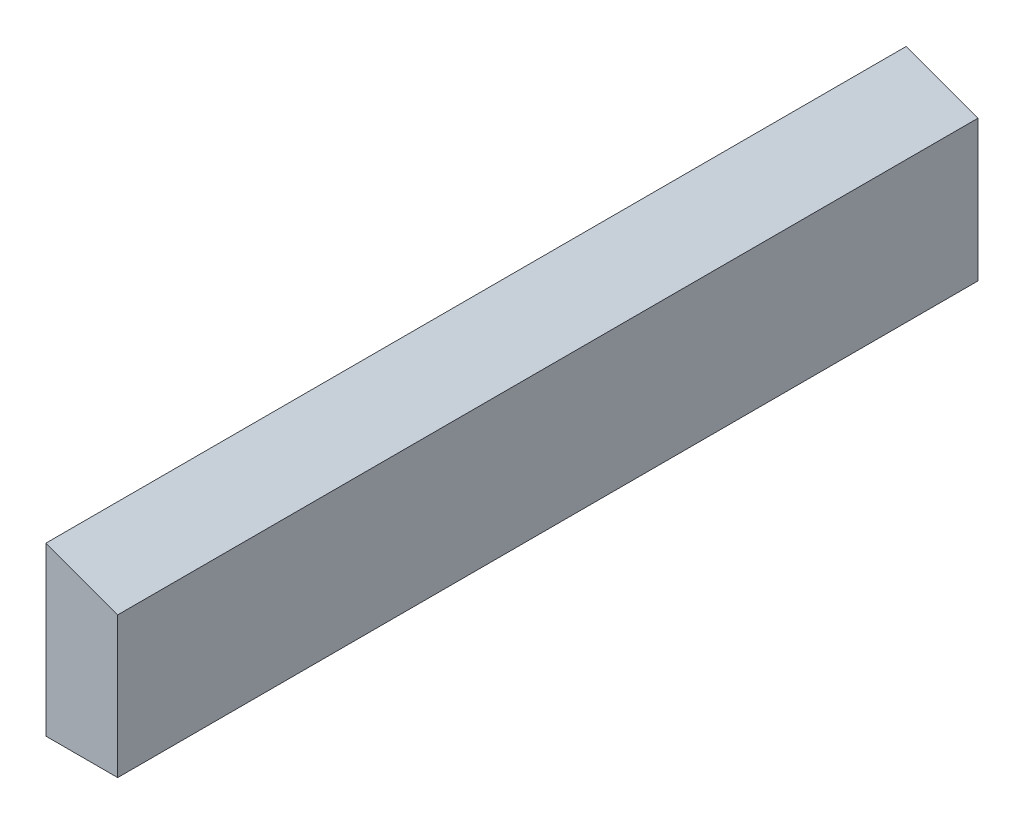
SolidWorks part; units mm, degrees
ref_plane "Front Plane" through (0, 0, 0) normal (0, 0, 1) x (1, 0, 0)
ref_plane "Top Plane" through (0, 0, 0) normal (0, 1, 0) x (1, 0, 0)
ref_plane "Right Plane" through (0, 0, 0) normal (1, 0, 0) x (0, 0, -1)
sketch "Sketch1" plane through (0, 0, 0) normal (0, 0, 1) x (1, 0, 0)
  line L1 (-19.05, -44.45) -> (19.05, -44.45)
  line L2 (-19.05, -44.45) -> (-19.05, 44.45)
  line L3 (-19.05, 44.45) -> (19.05, 44.45)
  line L4 (19.05, -44.45) -> (19.05, 44.45)
  line L5 (-19.05, -44.45) -> (19.05, 44.45) construction
  line L6 (-19.05, 44.45) -> (19.05, -44.45) construction
  point P0 (0, 0)
  dimension "D1" = 38.1
  dimension "D2" = 88.9
extrude "Boss-Extrude1" add sketch "Sketch1" against normal blind 457.2 contours L3 L4 L1 L2
sketch "Sketch2" plane through (0, 0, 0) normal (0, 0, 1) x (1, 0, 0)
  line L0 (-19.05, 44.45) -> (19.05, 30.4508)
  line L1 (19.05, -44.45) -> (19.05, 44.45) construction
  line L2 (19.05, 30.4508) -> (19.05, 44.45)
  line L4 (19.05, 44.45) -> (-19.05, 44.45)
  line L5 (-19.05, 44.45) -> (-19.3158, 44.379)
  dimension "D1" = 20.175
extrude "Cut-Extrude1" cut sketch "Sketch2" against normal through all contours L0 L2 L4
ref_plane "Plane1" through (0, 0, -228.6) normal (0, 0, 1) x (1, 0, 0)
